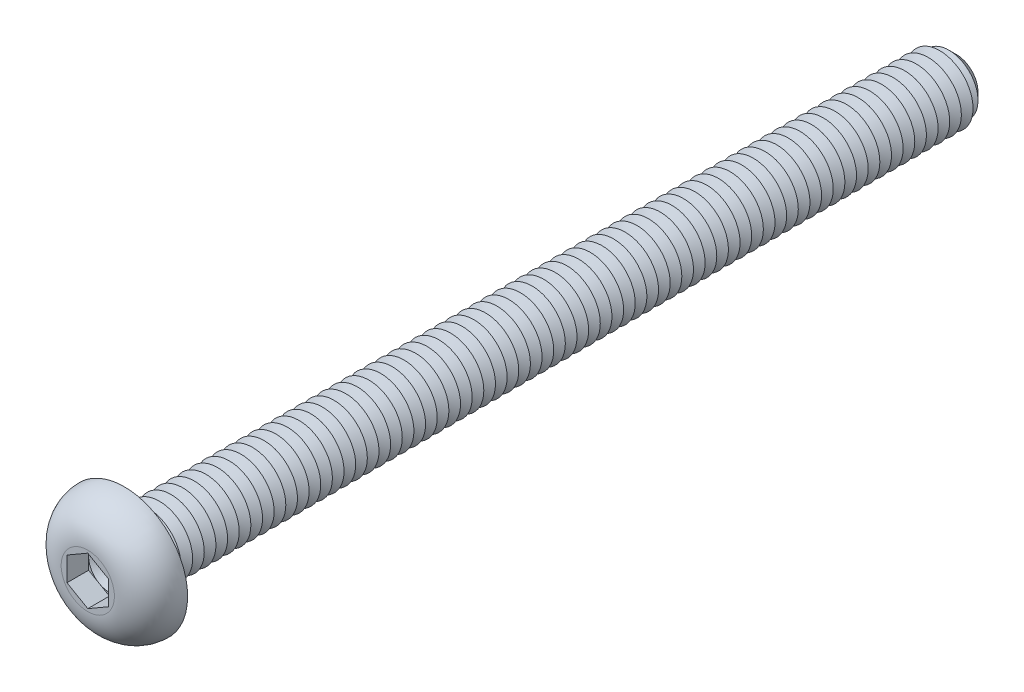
SolidWorks part; units mm, degrees
ref_plane "Front Plane" through (0, 0, 0) normal (0, 0, 1) x (1, 0, 0)
ref_plane "Top Plane" through (0, 0, 0) normal (0, 1, 0) x (1, 0, 0)
ref_plane "Right Plane" through (0, 0, 0) normal (1, 0, 0) x (0, 0, -1)
sketch "Sketch1" plane through (0, 0, 0) normal (1, 0, 0) x (0, 0, -1)
  line L0 (-47.9342, 0) -> (60.3146, 0) construction
sketch "Sketch2" plane through (0, 0, 0) normal (1, 0, 0) x (0, 0, -1)
  line L0 (0, 0) -> (-2.2, 0)
  line L1 (-47.9342, 0) -> (60.3146, 0) construction
  line L2 (-2.2, 0) -> (-2.2, 1.6)
  line L3 (0, 3.8) -> (0, 0)
  arc A0 (-2.2, 1.6) -> (0, 3.8) centre (0, 1.6) cw
  dimension "D1" = 2.2
  dimension "D2" = 2.2
  dimension "D3" = 3.8
revolve "Revolve1" add sketch "Sketch2" angle 360 about L0
sketch "Sketch3" plane through (0, 0, 2.2) normal (0, 0, 1) x (1, 0, 0)
  line L1 (0, 1.4434) -> (-1.25, 0.7217)
  line L2 (-1.25, 0.7217) -> (-1.25, -0.7217)
  line L3 (-1.25, -0.7217) -> (0, -1.4434)
  line L4 (0, -1.4434) -> (1.25, -0.7217)
  line L5 (1.25, -0.7217) -> (1.25, 0.7217)
  line L6 (1.25, 0.7217) -> (0, 1.4434)
  circle A0 centre (0, 0) radius 1.25 construction
  dimension "D1" = 2.5
extrude "Cut-Extrude1" cut sketch "Sketch3" against normal blind 1.3
sketch "Sketch4" plane through (0, 0, 0) normal (0, 0, -1) x (-1, 0, 0)
  circle A0 centre (0, 0) radius 2
  dimension "D1" = 4
extrude "Boss-Extrude1" add sketch "Sketch4" along normal blind 50
chamfer "Chamfer1" distance 0.7 angle 45 1 edges at (-2, 0, -50)
sketch "Sketch5" plane through (0, 0, 0) normal (1, 0, 0) x (0, 0, -1)
  line L0 (0.7, 2) -> (1.4, 2)
  line L1 (49.3, 2) -> (0, 2) construction
  line L2 (1.4, 2) -> (1.05, 1.3938)
  line L3 (1.05, 1.3938) -> (0.7, 2)
  line L4 (0, -3.8) -> (0, 3.8) construction
  line L5 (49.3, 2) -> (0, 2) construction
  dimension "D1" = 0.7
  dimension "D2" = 0.7
revolve "Cut-Revolve1" cut sketch "Sketch5" angle 360 about L0
pattern_linear "LPattern1" count 70 spacing 0.7 along (0, 0, -1) of "Cut-Revolve1"
fillet "Fillet2" radius 0.3 1 edges at (2, 0, 0)
sketch "Sketch6" plane through (0, 0, 0.9) normal (0, 0, 1) x (1, 0, 0)
  line L0 (0, -1.4434) -> (1.25, -0.7217) construction
  circle A0 centre (0, 0) radius 1.25
extrude "Cut-Extrude2" cut sketch "Sketch6" against normal through all draft 60
